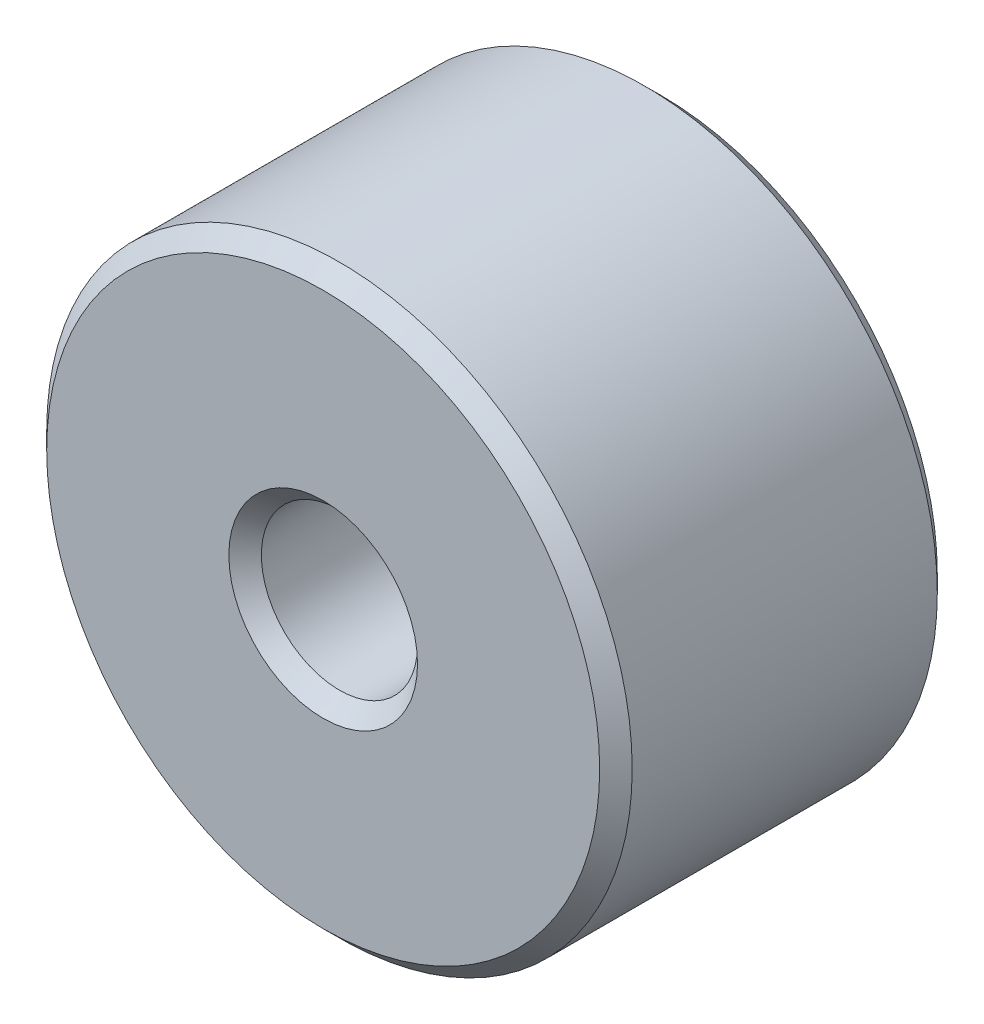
SolidWorks part; units mm, degrees
ref_plane "Front Plane" through (0, 0, 0) normal (0, 0, 1) x (1, 0, 0)
ref_plane "Top Plane" through (0, 0, 0) normal (0, 1, 0) x (1, 0, 0)
ref_plane "Right Plane" through (0, 0, 0) normal (1, 0, 0) x (0, 0, -1)
sketch "Sketch1" plane through (0, 0, 0) normal (0, 0, 1) x (1, 0, 0)
  circle A0 centre (0, 0) radius 9
  circle A1 centre (0, 0) radius 2.4
  dimension "D1" = 18
  dimension "D2" = 4.8
extrude "Boss-Extrude1" add sketch "Sketch1" along normal mid plane 10.38
chamfer "Chamfer1" distance 0.5 angle 45 4 edges at (2.4, 0, -5.19) (9, 0, -5.19) (9, 0, 5.19) (2.4, 0, 5.19)
